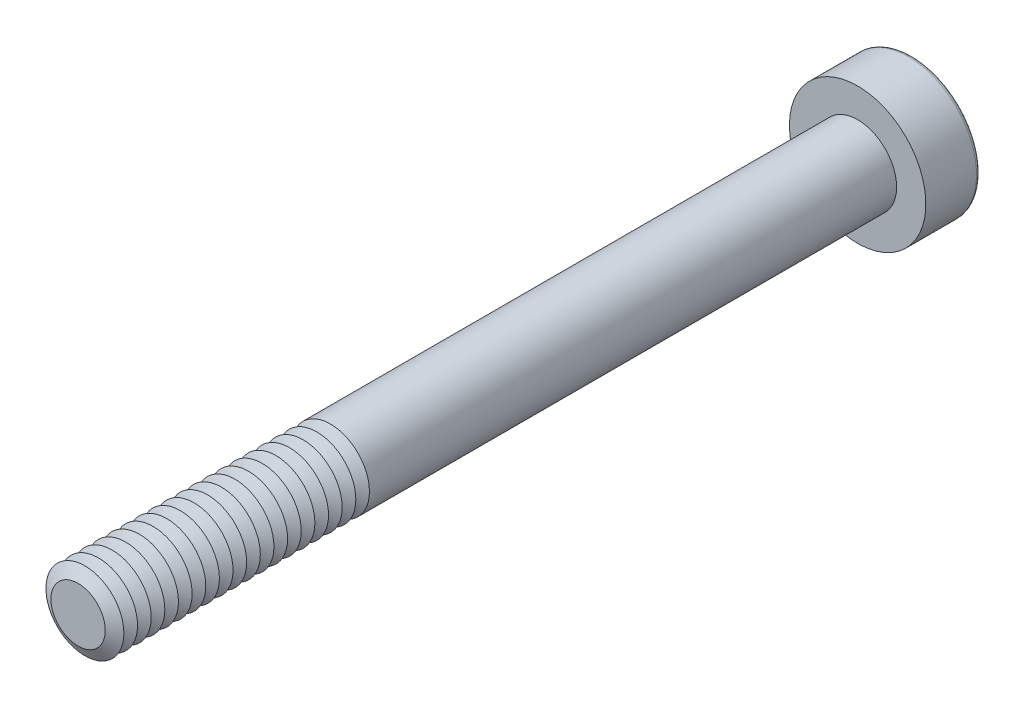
SolidWorks part; units mm, degrees
ref_plane "Front Plane" through (0, 0, 0) normal (0, 0, 1) x (1, 0, 0)
ref_plane "Top Plane" through (0, 0, 0) normal (0, 1, 0) x (1, 0, 0)
ref_plane "Right Plane" through (0, 0, 0) normal (1, 0, 0) x (0, 0, -1)
sketch "Sketch1" plane through (0, 0, 0) normal (0, 0, 1) x (1, 0, 0)
  circle A0 centre (0, 0) radius 2
  dimension "D1" = 4
extrude "Boss-Extrude1" add sketch "Sketch1" along normal blind 40
sketch "Sketch2" plane through (0, 0, 0) normal (0, 0, -1) x (-1, 0, 0)
  circle A0 centre (0, 0) radius 3.5
  dimension "D1" = 7
extrude "Boss-Extrude2" add sketch "Sketch2" along normal blind 2.8
sketch "Sketch3" plane through (0, 0, -2.8) normal (0, 0, -1) x (-1, 0, 0)
  line L1 (-0.7217, 1.25) -> (-1.4434, 0)
  line L2 (-1.4434, 0) -> (-0.7217, -1.25)
  line L3 (-0.7217, -1.25) -> (0.7217, -1.25)
  line L4 (0.7217, -1.25) -> (1.4434, 0)
  line L5 (1.4434, 0) -> (0.7217, 1.25)
  line L6 (0.7217, 1.25) -> (-0.7217, 1.25)
  circle A0 centre (0, 0) radius 1.25 construction
  dimension "D1" = 2.5
extrude "Cut-Extrude1" cut sketch "Sketch3" against normal blind 1.875
fillet "Fillet1" radius 0.2 1 edges at (-3.5, 0, -2.8)
sketch "Sketch4" plane through (0, 0, -0.925) normal (0, 0, -1) x (-1, 0, 0)
  line L0 (0.7217, -1.25) -> (1.4434, 0) construction
  circle A0 centre (0, 0) radius 1.25
extrude "Cut-Extrude2" cut sketch "Sketch4" against normal through all draft 60
sketch "Sketch5" plane through (0, 0, -2.8) normal (0, 0, -1) x (-1, 0, 0)
  circle A0 centre (0, 0) radius 1.4434
extrude "Cut-Extrude3" cut sketch "Sketch5" against normal through all draft 75
sketch "Sketch7" plane through (0, 0, 0) normal (1, 0, 0) x (0, 0, -1)
  line L25 (-40, 1.3938) -> (-39.65, 2)
  line L26 (-40, 2) -> (-40, -2) construction
  line L27 (-39.65, 2) -> (-40.35, 2)
  line L28 (-40.35, 2) -> (-40, 1.3938)
  line L29 (0, 2) -> (-40, 2) construction
  dimension "D1" = 0.7
revolve "Cut-Revolve1" cut sketch "Sketch7" angle 360 about axis through (0, 0, 40) along (0, 0, -1)
pattern_linear "LPattern1" count 19 spacing 0.7 along (0, 0, -1) of "Cut-Revolve1"
